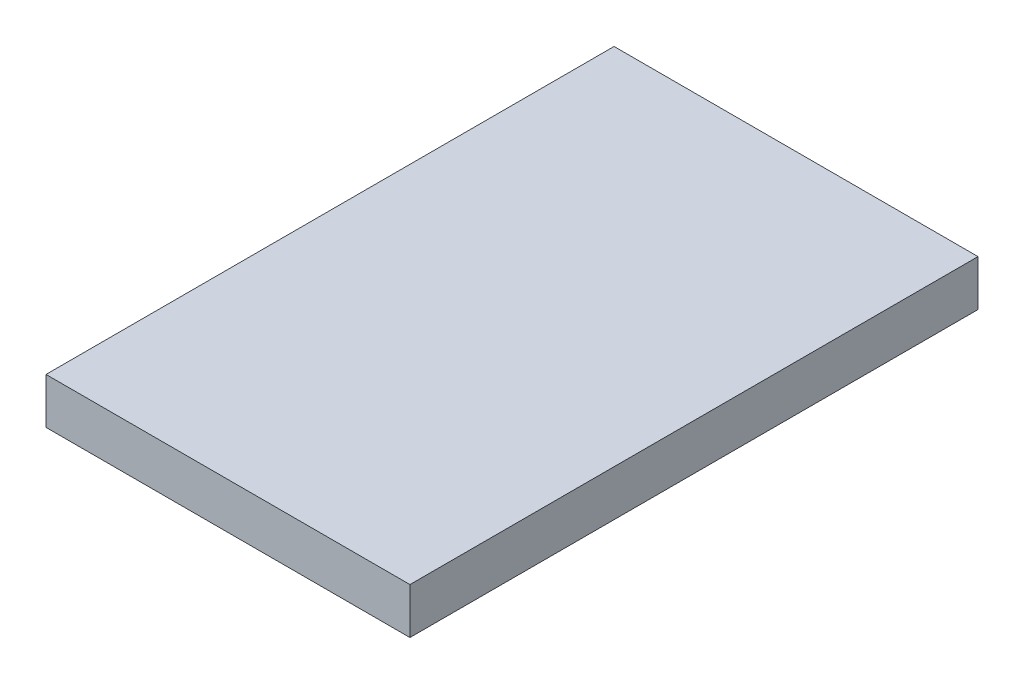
SolidWorks part; units mm, degrees
ref_plane "Front Plane" through (0, 0, 0) normal (0, 0, 1) x (1, 0, 0)
ref_plane "Top Plane" through (0, 0, 0) normal (0, 1, 0) x (1, 0, 0)
ref_plane "Right Plane" through (0, 0, 0) normal (1, 0, 0) x (0, 0, -1)
sketch "Sketch1" plane through (0, 0, 0) normal (0, 1, 0) x (1, 0, 0)
  line L0 (44.8839, -70.0584) -> (-44.8839, 70.0584) construction
  line L1 (-44.8839, 70.0584) -> (44.8839, 70.0584)
  line L2 (-44.8839, 70.0584) -> (-44.8839, -70.0584)
  line L3 (-44.8839, -70.0584) -> (44.8839, -70.0584)
  line L4 (44.8839, 70.0584) -> (44.8839, -70.0584)
extrude "Extrude1" add sketch "Sketch1" along normal blind 11.319
sketch "Sketch2" plane through (0, 11.319, 0) normal (0, 1, 0) x (-1, 0, 0)
  line L1 (25.3836, 35.7002) -> (-1.8253, 35.7002)
  line L2 (25.3836, 35.7002) -> (25.3836, -35.7002)
  line L3 (25.3836, -35.7002) -> (-1.8253, -35.7002)
  line L4 (-1.8253, 35.7002) -> (-1.8253, -35.7002)
sketch "Sketch3" plane through (0, 0, 70.0584) normal (0, 0, 1) x (1, 0, 0)
  line L0 (-44.8839, 0) -> (-84.2245, 51.5527)
